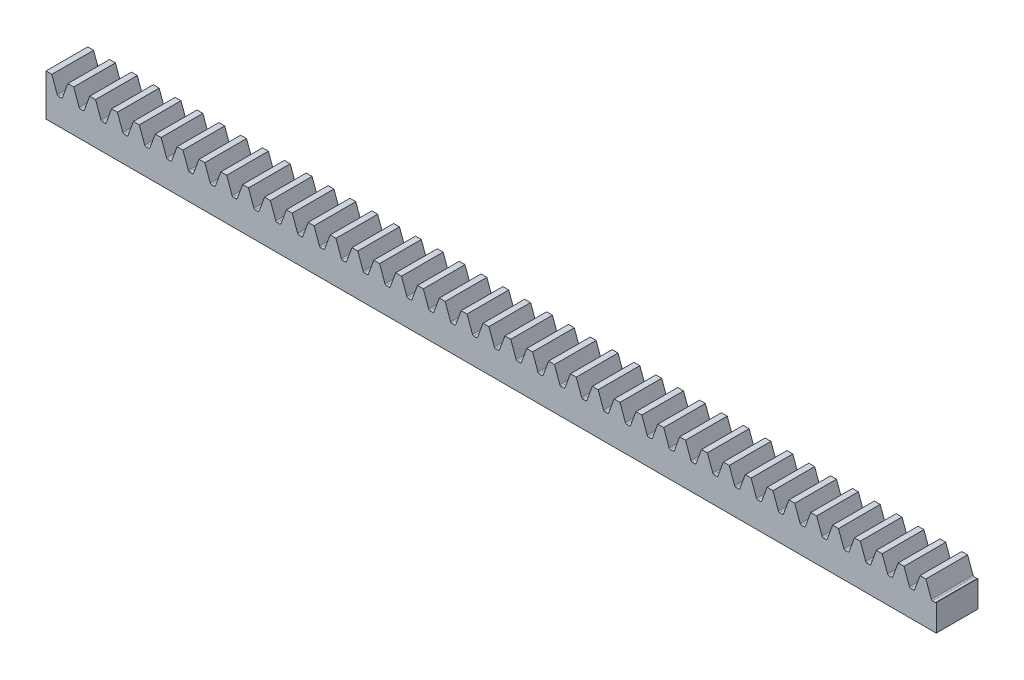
SolidWorks part; units mm, degrees
ref_plane "Front Plane" through (0, 0, 0) normal (0, 0, 1) x (1, 0, 0)
ref_plane "Top Plane" through (0, 0, 0) normal (0, 1, 0) x (1, 0, 0)
ref_plane "Right Plane" through (0, 0, 0) normal (1, 0, 0) x (0, 0, -1)
sketch "Sketch1" plane through (0, 0, 0) normal (0, 0, 1) x (1, 0, 0)
  line L0 (0, 0) -> (-50.8, 0) construction
  line L1 (0, 0) -> (50.8, 0) construction
  line L2 (0, 0) -> (0, 4.7625) construction
  line L3 (-50.8, 3.9624) -> (50.8, 3.9624) construction
  point P3 (762, 0)
  point P7 (0, 4.7625)
sketch "Sketch2" plane through (0, 0, 0) normal (1, 0, 0) x (0, 0, -1)
  line L0 (0, 0) -> (0, 4.7625) construction
  line L1 (2.3813, 4.7625) -> (-2.3813, 4.7625)
  line L2 (0, 2.3813) -> (-2.3813, 2.3813) construction
  line L3 (0, 2.3813) -> (2.3813, 2.3812) construction
  line L4 (-2.3813, 4.7625) -> (-2.3812, 0)
  line L5 (-2.3812, 0) -> (2.3813, 0)
  line L6 (2.3813, 0) -> (2.3813, 4.7625)
  dimension "Width" = 4.7625
extrude "Boss-Extrude1" add sketch "Sketch2" along normal up to vertex and the other way up to vertex
sketch "Sketch3" plane through (0, 0, 0) normal (0, 0, 1) x (1, 0, 0)
  line L0 (-50.131, 4.7625) -> (-49.4769, 2.9655)
  line L2 (-49.4769, 2.9655) -> (-48.9604, 2.9655)
  line L3 (-48.9604, 2.9655) -> (-48.3064, 4.7625)
  line L4 (-50.131, 4.7625) -> (-48.3064, 4.7625)
  line L5 (-50.131, 4.7625) -> (-50.8, 4.7625) construction
  line L6 (-48.3064, 4.7625) -> (-47.6373, 4.7625) construction
  line L7 (-47.6373, 4.7625) -> (-46.9833, 2.9654) construction
  line L8 (-49.2187, 2.9654) -> (-49.2187, 4.7625) construction
  line L9 (-49.8421, 3.9687) -> (-48.5953, 3.9687) construction
  line L10 (-48.5953, 3.9687) -> (-48.5953, 4.7625) construction
  line L11 (-47.3484, 3.9687) -> (-47.3484, 2.9654) construction
  line L12 (-48.5953, 3.9687) -> (-47.3484, 3.9687) construction
  line L13 (-50.8, 4.7625) -> (-50.8, 0) construction
  line L14 (50.8, 4.7625) -> (-50.8, 4.7625) construction
extrude "Cut-Extrude1" cut sketch "Sketch3" against normal through all both and the other way through all
fillet "Fillet1" radius 0.1549 2 edges at (-48.9604, 2.9655, 0) (-49.4769, 2.9655, 0)
pattern_linear "LPattern1" count 44 spacing 2.4936 along (1, 0, 0) of "Cut-Extrude1", "Fillet1"
equation "\"D3@Sketch3\"=(2.2/\"Diametral Pitch@Sketch1\")+.002"
equation "\"D4@Sketch3\"=1/\"Diametral Pitch@Sketch1\""
equation "\"D5@Sketch3\"=3.1416/\"Diametral Pitch@Sketch1\""
equation "\"D1@Fillet1\"=\"D6@Sketch3\"*.3"
equation "\"D3@LPattern1\"=\"D5@Sketch3\""
equation "\"D1@LPattern1\"=\"Overall Length@Sketch1\"*11"
